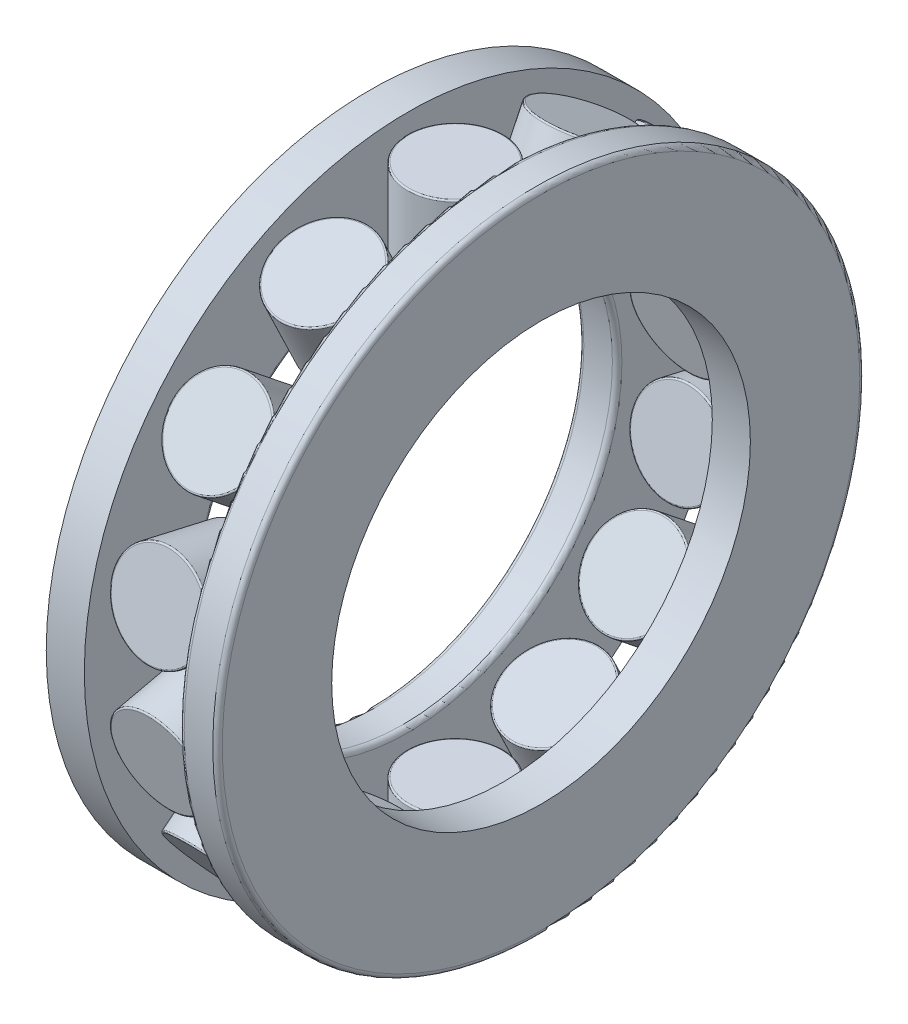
SolidWorks part; units mm, degrees
ref_plane "Plane1" through (0, 0, 0) normal (0, 0, 1) x (1, 0, 0)
ref_plane "Plane2" through (0, 0, 0) normal (0, 1, 0) x (1, 0, 0)
ref_plane "Plane3" through (0, 0, 0) normal (1, 0, 0) x (0, 0, -1)
sketch "Clipboard" plane through (0, 0, 0) normal (0, 0, 1) x (1, 0, 0)
  line L0 (-10, 0) -> (10, 0) construction
  line L1 (0, 0) -> (21.6965, -5.4095)
  line L2 (0, 0) -> (27.3662, 35.0271)
  line L3 (0, 0) -> (13.7666, -17.6205)
  line L4 (0, 0) -> (-22.3471, -0.7804)
  dimension "BallCLRad" = 44.45
  dimension "Count" = 52
  dimension "Show_count" = 52
  dimension "Max_count" = 14
  dimension "Min_count" = 2
sketch "InnRacSke" plane through (0, 0, 0) normal (0, 0, 1) x (1, 0, 0)
  line L1 (-7.9375, 34.925) -> (-14.2875, 34.925)
  line L2 (-14.2875, 34.925) -> (-14.2875, 53.975)
  line L3 (-14.2875, 53.975) -> (-7.9375, 53.975)
  line L4 (-7.9375, 53.975) -> (-7.9375, 34.925)
  line L5 (-34.925, 0) -> (34.925, 0) construction
  line L6 (0, 0) -> (0, 25.4) construction
  dimension "ID" = 69.85
  dimension "OD" = 107.95
  dimension "Width" = 28.575
  dimension "gap" = 15.875
revolve "Race" add sketch "InnRacSke" angle 360 about L5
ref_axis "Axis1" through (-50, 0, 0) along (1, 0, 0)
sketch "RolDetSke" plane through (0, 0, 0) normal (0, 0, 1) x (1, 0, 0)
  line L0 (0, 33.02) -> (0, 55.88) construction
  line L3 (0, 50.8) -> (7.7232, 50.8)
  line L4 (0, 50.8) -> (0, 38.1)
  line L5 (0, 38.1) -> (7.7232, 38.1)
  line L6 (7.9772, 50.546) -> (7.9772, 38.354)
  arc A0 (7.9772, 38.354) -> (7.7232, 38.1) centre (7.7232, 38.354) cw
  arc A1 (7.7232, 50.8) -> (7.9772, 50.546) centre (7.7232, 50.546) cw
  dimension "D1" = 0.254
  dimension "Roller_diameter" = 15.9544
  dimension "Cyl_Len" = 12.7
  dimension "offset" = 38.1
revolve "RollerDetailed" add sketch "RolDetSke" angle 360 about L0
sketch "RolSimSke" plane through (0, 0, 0) normal (0, 0, 1) x (1, 0, 0)
  line L1 (-17.78, 0) -> (12.7, 0) construction
  line L3 (-7.7232, 50.8) -> (7.7232, 50.8)
  line L4 (-7.9772, 50.546) -> (-7.9772, 38.354)
  line L5 (-7.7232, 38.1) -> (7.7232, 38.1)
  line L6 (7.9772, 50.546) -> (7.9772, 38.354)
  arc A0 (-7.9772, 38.354) -> (-7.7232, 38.1) centre (-7.7232, 38.354) ccw
  arc A1 (-7.7232, 50.8) -> (-7.9772, 50.546) centre (-7.7232, 50.546) ccw
  arc A2 (7.9772, 50.546) -> (7.7232, 50.8) centre (7.7232, 50.546) ccw
  arc A3 (7.7232, 38.1) -> (7.9772, 38.354) centre (7.7232, 38.354) ccw
  dimension "Rol_rad" = 0.254
  dimension "Roller_diameter" = 15.9544
  dimension "Cyl_Len" = 12.7
  dimension "offset" = 38.1
  dimension "Halfdia" = 7.9772
revolve "RollersSimplified" [suppressed] add sketch "RolSimSke" angle 360 about L1
mirror "Mirror1" about plane through (0, 0, 0) normal (1, 0, 0) of "Race"
fillet "Fillet" radius 0.7937 4 edges at (14.2875, 0, -53.975) (7.9375, 0, -53.975) (-14.2875, 0, -34.925) (-7.9375, 0, -34.925)
pattern_circular "RollersDetailed" count 14 every 25.714 about axis through (-50, 0, 0) along (1, 0, 0) of "RollerDetailed"
sketch "CagSpiSke" plane through (0, 0, 0) normal (0, 0, 1) x (1, 0, 0)
  line L0 (2.3932, 35.6235) -> (2.3932, 52.8955)
  line L1 (2.3932, 52.8955) -> (-2.3932, 52.8955)
  line L2 (-2.3932, 35.6235) -> (-2.3932, 52.8955)
  line L3 (-2.3932, 35.6235) -> (2.3932, 35.6235)
  line L4 (-34.925, 0) -> (34.925, 0) construction
  line L5 (0, 0) -> (0, 55.5677) construction
  dimension "Thickness" = 4.7863
  dimension "ID" = 71.247
  dimension "OD" = 105.791
revolve "CageSpine" [suppressed] add sketch "CagSpiSke" angle 360 about L4
equation "\"BallCLRad@Clipboard\" =  ( \"OD@InnRacSke\" + \"ID@InnRacSke\" )  / 4"
equation "\"offset@RolDetSke\" = \"BallCLRad@Clipboard\" - \"Cyl_Len@RolDetSke\" / 2"
equation "\"Roller_diameter@RolDetSke\" = \"gap@InnRacSke\" * 1.005"
equation "\"Cyl_Len@RolSimSke\" = \"Cyl_Len@RolDetSke\""
equation "\"offset@RolSimSke\" = \"BallCLRad@Clipboard\" - \"Cyl_Len@RolSimSke\" / 2"
equation "\"Roller_diameter@RolSimSke\" = \"Roller_diameter@RolDetSke\""
equation "\"Halfdia@RolSimSke\" = \"Roller_diameter@RolSimSke\" / 2"
equation "\"Max_count@Clipboard\" = int( 3.14159265 / atn(( \"Roller_diameter@RolDetSke\" / 2) / sqr( \"offset@RolDetSke\"  *  \"offset@RolDetSke\" - ( \"Roller_diameter@RolDetSke\" / 2) *  ( \"Roller_diameter@RolDetSke\" "
equation "\"Max_count@Clipboard\" = ((sgn( \"Max_count@Clipboard\" - \"Count@Clipboard\" )-1)*( \"Max_count@Clipboard\" - \"Count@Clipboard\" ))/-2+ \"Count@Clipboard\""
equation "\"Count@RollersDetailed\" = int( \"Show_count@Clipboard\" ) "
equation "\"Count@RollersDetailed\" = ((sgn( \"Count@RollersDetailed\" - \"Max_count@Clipboard\" )-1)*( \"Count@RollersDetailed\" - \"Max_count@Clipboard\" ))/-2+ \"Max_count@Clipboard\""
equation "\"Count@RollersDetailed\" = ((sgn( \"Count@RollersDetailed\" - \"Min_count@Clipboard\" )+1)*( \"Count@RollersDetailed\" - \"Min_count@Clipboard\"))/2 +\"Min_count@Clipboard\""
equation "\"Angle@RollersDetailed\" = 360.0 / \"Max_count@Clipboard\""
equation "\"Angle@CageSpine\" =  \"Angle@RollersDetailed\" * ( \"Count@RollersDetailed\" -1 + int( \"Count@RollersDetailed\" / \"Max_count@Clipboard\" ) )  + 0.001 -  int( \"Count@RollersDetailed\" / \"Max_count@Clipboard\" "
equation "\"Angle@CageSpine\" =  \"Angle@CageSpine\" * int( \"Min_count@Clipboard\" / 2) + int(1 / \"Min_count@Clipboard\")  * 0.001"
equation "\"Thickness@CagSpiSke\" =  \"Roller_diameter@RolDetSke\" * 0.3"
equation "\"OD@CagSpiSke\" = \"OD@InnRacSke\" * 0.98"
equation "\"ID@CagSpiSke\" =  \"ID@InnRacSke\" * 1.02"
